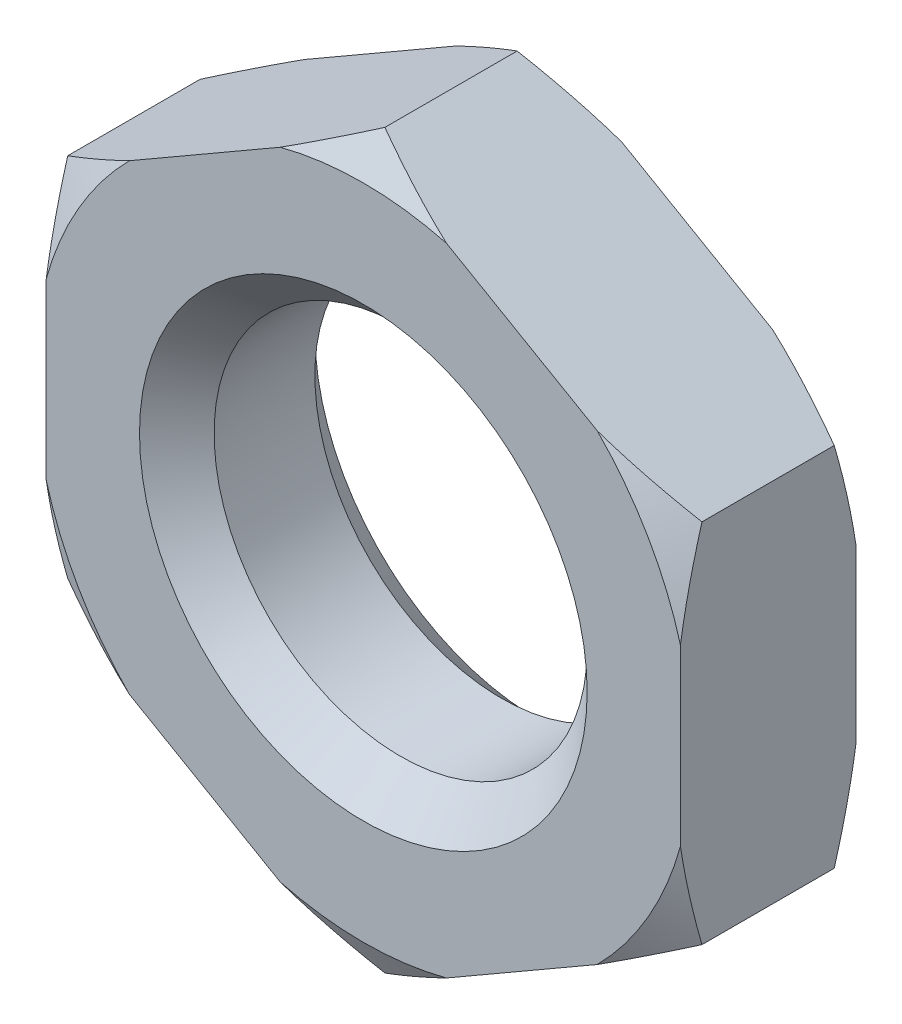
SolidWorks part; units mm, degrees
ref_plane "Front Plane" through (0, 0, 0) normal (0, 0, 1) x (1, 0, 0)
ref_plane "Top Plane" through (0, 0, 0) normal (0, 1, 0) x (1, 0, 0)
ref_plane "Right Plane" through (0, 0, 0) normal (1, 0, 0) x (0, 0, -1)
sketch "Sketch1" plane through (0, 0, 0) normal (0, 0, 1) x (1, 0, 0)
  line L1 (0, 9.815) -> (-8.5, 4.9075)
  line L2 (-8.5, 4.9075) -> (-8.5, -4.9075)
  line L3 (-8.5, -4.9075) -> (0, -9.815)
  line L4 (0, -9.815) -> (8.5, -4.9075)
  line L5 (8.5, -4.9075) -> (8.5, 4.9075)
  line L6 (8.5, 4.9075) -> (0, 9.815)
  circle A0 centre (0, 0) radius 8.5 construction
  circle A1 centre (0, 0) radius 5
  dimension "D2" = 10
  dimension "D1" = 17
extrude "Boss-Extrude1" add sketch "Sketch1" along normal mid plane 4.7
sketch "Sketch2" plane through (0, 0, 0) normal (1, 0, 0) x (0, 0, -1)
  line L0 (7.477, 0) -> (-8.5759, 0) construction
sketch "Sketch3" plane through (0, 0, 0) normal (1, 0, 0) x (0, 0, -1)
  line L0 (-2.35, 9.815) -> (-2.35, 8.815)
  line L1 (-2.35, 4.9075) -> (-2.35, 9.815) construction
  line L2 (-2.35, 8.815) -> (-1.7726, 9.815)
  line L3 (-2.35, 9.815) -> (2.35, 9.815) construction
  line L4 (-1.7726, 9.815) -> (-2.35, 9.815)
  dimension "D1" = 1
  dimension "D2" = 30
revolve "Cut-Revolve1" cut sketch "Sketch3" angle 360 about L0
mirror "Mirror1" about plane through (0, 0, 0) normal (0, 0, 1) of "Cut-Revolve1"
chamfer "Chamfer1" distance 1 angle 45 2 edges at (5, 0, -2.35) (5, 0, 2.35)
